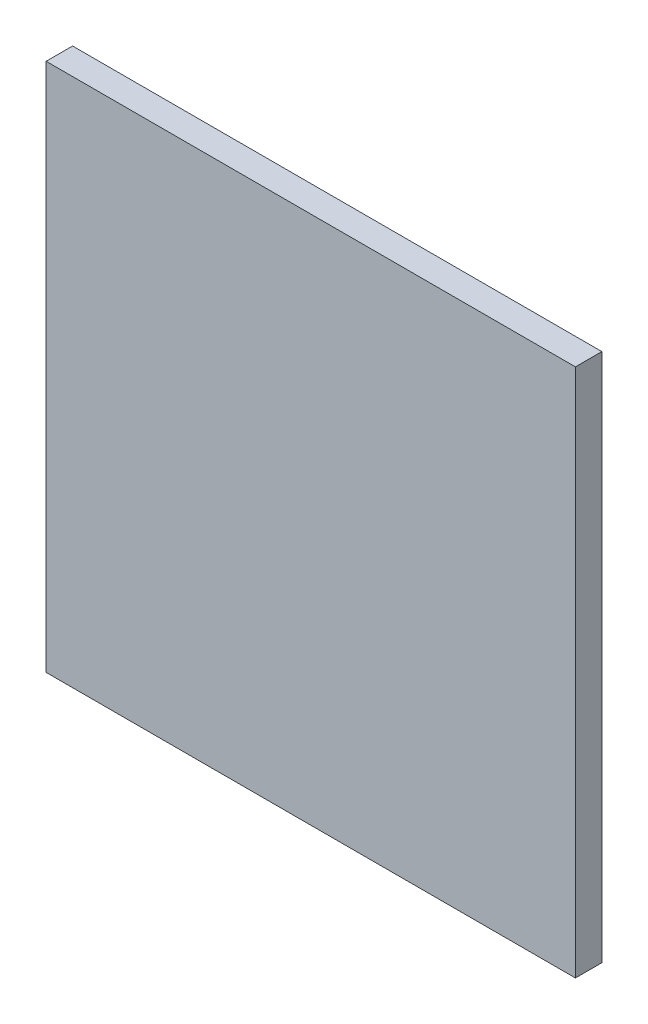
SolidWorks part; units mm, degrees
other "<spur gear_am>-<Bore>"
other "<rack spur rectangular_am>-<TeethCuts>"
other "<rack spur rectangular_am>-<TeethCuts>"
ref_plane "Front Plane" through (0, 0, 0) normal (0, 0, 1) x (1, 0, 0)
ref_plane "Top Plane" through (0, 0, 0) normal (0, 1, 0) x (1, 0, 0)
ref_plane "Right Plane" through (0, 0, 0) normal (1, 0, 0) x (0, 0, -1)
inserted part "rack spur rectangular_am"
inserted part "rack spur rectangular_am1"
move or copy body "Body-Move/Copy1" bodies to move or copy 102 copy no rotation origin (0, -15.9518, 12.7) rotation axis (1, 0, 0) rotation angle 180
move or copy body "Body-Move/Copy2" bodies to move or copy 103 placed by mates yes
inserted part "spur gear_am"
move or copy body "Body-Move/Copy3" bodies to move or copy 105 copy no rotation origin (-79.4449, 0, -0.0283) rotation axis (0, 1, 0) rotation angle 90
move or copy body "Body-Move/Copy4" bodies to move or copy 106 placed by mates yes
move or copy body "Body-Move/Copy5" bodies to move or copy 107 copy no translate (0, -2, 0)
move or copy body "Body-Move/Copy6" bodies to move or copy 108 copy yes number of copies 1 translate (0, 107.1845, 0)
move or copy body "Body-Move/Copy7" bodies to move or copy 109 copy yes number of copies 1 translate (-61.8041, 47.4698, 0)
move or copy body "Body-Move/Copy8" bodies to move or copy 108 copy yes number of copies 1 translate (-60.256, -46.535, 0)
sketch "Sketch3" plane through (0, 0, 0) normal (0, 0, 1) x (1, 0, 0)
  line L1 (-189.3609, 157.04) -> (229.1851, 157.04)
  line L2 (-189.3609, 157.04) -> (-189.3609, -158.0624)
  line L3 (-189.3609, -158.0624) -> (229.1851, -158.0624)
  line L4 (229.1851, 157.04) -> (229.1851, -158.0624)
extrude "Boss-Extrude1" add sketch "Sketch3" along normal blind 10 separate body contours L1 L4 L3 L2
move or copy body "Body-Move/Copy9" bodies to move or copy 112 placed by mates yes
sketch "Sketch4" plane through (0, 0, -9.6551) normal (0, 0, -1) x (-1, 0, 0)
  circle A0 centre (86.8979, -91.1644) radius 9.525
  circle A1 centre (26.6419, -44.6294) radius 9.525
  circle A2 centre (26.6419, 62.5551) radius 9.525
  circle A3 centre (88.4062, 110.0021) radius 9.5709
extrude "Boss-Extrude3" add sketch "Sketch4" along normal blind 25
sketch "Sketch5" plane through (0, 0, -22.3551) normal (0, 0, -1) x (-1, 0, 0)
  line L1 (312.4026, -116.1644) -> (62.4026, -116.1644)
  line L2 (312.4026, -116.1644) -> (312.4026, -66.1644)
  line L3 (312.4026, -66.1644) -> (62.4026, -66.1644)
  line L4 (62.4026, -116.1644) -> (62.4026, -66.1644)
  line L5 (312.4026, 85.0021) -> (62.4026, 85.0021)
  line L6 (312.4026, 85.0021) -> (312.4026, 135.0021)
  line L7 (312.4026, 135.0021) -> (62.4026, 135.0021)
  line L8 (62.4026, 85.0021) -> (62.4026, 135.0021)
  circle A0 centre (86.8979, -91.1644) radius 9.525 construction
  circle A1 centre (88.4062, 110.0021) radius 9.5709 construction
  dimension "D6" = 25
  dimension "D1" = 250
  dimension "D2" = 250
  dimension "D3" = 50
  dimension "D4" = 50
  dimension "D5" = 25
extrude "Boss-Extrude4" add sketch "Sketch5" along normal blind 10
move or copy body "Body-Move/Copy10" bodies to move or copy 104 copy yes number of copies 1 translate (120, 0, 0)
move or copy body "Body-Move/Copy12" bodies to move or copy 117 placed by mates yes
move or copy body "Body-Move/Copy13" bodies to move or copy 101 copy yes number of copies 1 translate (120.0202, 0, 0)
move or copy body "Body-Move/Copy14" bodies to move or copy 120 placed by mates yes
combine bodies "Combine1" operation type add bodies to combine 116 104 101 121 119
scale "Scale1" bodies to scale 122 scale about centroid uniform scaling yes scale factor 0.01
sketch "Sketch8" plane through (0, 0, 0) normal (0, 0, 1) x (1, 0, 0)
  line L1 (-25.0479, 3.0901) -> (-5.0479, 3.0901)
  line L2 (-25.0479, 3.0901) -> (-25.0479, 23.0901)
  line L3 (-25.0479, 23.0901) -> (-5.0479, 23.0901)
  line L4 (-5.0479, 3.0901) -> (-5.0479, 23.0901)
  dimension "D1" = 20
  dimension "D2" = 20
extrude "Boss-Extrude5" add sketch "Sketch8" along normal blind 1 separate body
move or copy body "Body-Move/Copy15" bodies to move or copy 123 copy no translate (0, 16.6046, 0)
sketch "Sketch10" plane through (0, 0, 0) normal (0, 0, -1) x (-1, 0, 0)
  text T0 "2 cm by 2 cm Plane" font "Century Gothic" height 1
move or copy body "Body-Move/Copy16" bodies to move or copy 125 copy no translate (0, 0, 8.6492)
